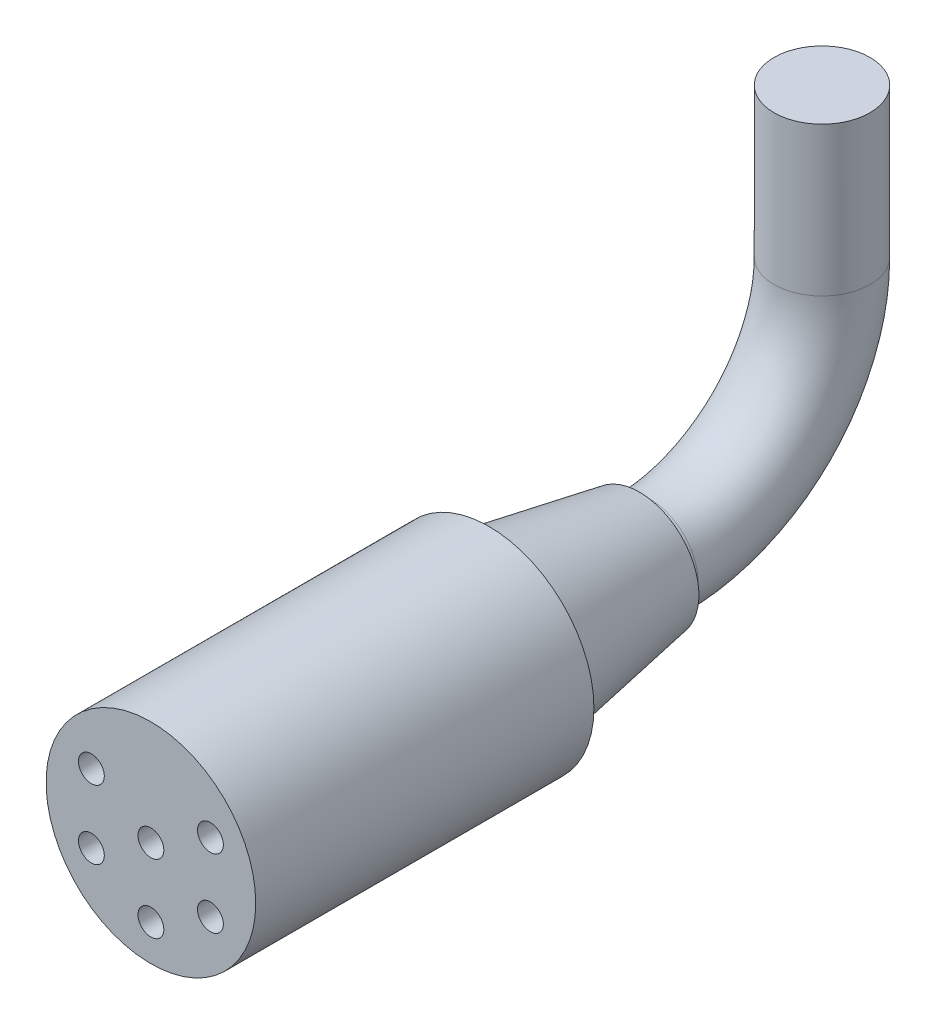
SolidWorks part; units mm, degrees
ref_plane "Front" through (0, 0, 0) normal (0, 0, 1) x (1, 0, 0)
ref_plane "Top" through (0, 0, 0) normal (0, 1, 0) x (1, 0, 0)
ref_plane "Right" through (0, 0, 0) normal (1, 0, 0) x (0, 0, -1)
sketch "Sketch1" plane through (0, 0, 0) normal (0, 0, 1) x (1, 0, 0)
  circle A0 centre (0, 0) radius 7.747
  dimension "D1" = 15.494
extrude "Extrude1" add sketch "Sketch1" against normal blind 25
sketch "Sketch6" plane through (0, 0, 0) normal (0, 0, 1) x (1, 0, 0)
  circle A0 centre (0, -5.08) radius 0.955
  circle A1 centre (0, 0) radius 5.08 construction
  dimension "D1" = 10.16
  dimension "D2" = 1.91
extrude "Extrude9" cut sketch "Sketch6" against normal blind 10
pattern_circular "CirPattern3" count 6 over 360 about axis through (0, 0, 0) along (0, 0, 1) of "Extrude9"
sketch "Sketch8" plane through (0, 0, 0) normal (0, 0, 1) x (1, 0, 0)
  circle A0 centre (0, 0) radius 0.955
  dimension "D1" = 1.91
extrude "Extrude10" cut sketch "Sketch8" against normal blind 10
sketch "Sketch2" plane through (0, 0, -25) normal (0, 0, -1) x (-1, 0, 0)
  circle A0 centre (0, 0) radius 6.3528
extrude "Extrude2" add sketch "Sketch2" along normal blind 11.1125 draft 10
sketch "Sketch3" plane through (0, 0, -36.1125) normal (0, 0, -1) x (-1, 0, 0)
  circle A0 centre (0, 0) radius 3.5433
  dimension "D1" = 7.0866
extrude "Extrude3" add sketch "Sketch3" along normal blind 0.7937
sketch "Sketch10" plane through (0, 0, 0) normal (1, 0, 0) x (0, 0, -1)
  line L0 (19.0568, 6.2489) -> (19.0568, 8.157)
  line L1 (19.0568, 8.157) -> (-2.0995, 8.157)
  line L2 (-20.94, 9.0278) -> (-20.94, 11)
  line L3 (-20.94, 11) -> (20.56, 11)
  line L4 (20.56, 11) -> (20.56, 6.2489)
  line L5 (20.56, 6.2489) -> (19.0568, 6.2489)
  line L6 (0, 0) -> (43.3086, 0) construction
  line L7 (25, 0) -> (0, 0) construction
  line L8 (-2.0995, 8.157) -> (-2.0995, 9.0278)
  line L9 (-2.0995, 9.0278) -> (-20.94, 9.0278)
  dimension "D1" = 22
  dimension "D2" = 41.5
revolve "Revolve2" [suppressed] add sketch "Sketch10" angle 360 about L6
sketch "Sketch12" [suppressed] plane through (0, 0, -20.56) normal (0, 0, -1) x (-1, 0, 0)
  arc A0 (0.7873, 10.9718) -> (-0.7873, 10.9718) centre (0, 11) ccw
  circle A1 centre (0, 0) radius 11 construction
  arc A2 (0.7873, 10.9718) -> (-0.7873, 10.9718) centre (0, 0) ccw
extrude "Extrude8" [suppressed] add sketch "Sketch12" against normal blind 11
pattern_circular "CirPattern2" [suppressed] count 4 over 360
sketch "Sketch5" plane through (0, 0, -36.9063) normal (0, 0, -1) x (-1, 0, 0)
  line L0 (38.9767, 12.7) -> (-34.8607, 12.7) construction
  circle A1 centre (0, 0) radius 3.5433
  circle A2 centre (0, 0) radius 3.5433
  dimension "D2" = 12.7
  dimension "D1" = 0
revolve "Belden 3120AType3PR24" add sketch "Sketch5" angle 90 about L0
sketch "Sketch11" plane through (0, 12.7, 0) normal (0, 1, 0) x (1, 0, 0)
  point P0 (0, 152.4)
sketch "Sketch13" plane through (0, 12.7, 0) normal (0, 1, 0) x (1, 0, 0)
  circle A1 centre (0, 49.6063) radius 3.5433
  circle A2 centre (0, 49.6063) radius 3.5433
  dimension "D1" = 0
extrude "Extrude11" add sketch "Sketch13" along normal blind 11
